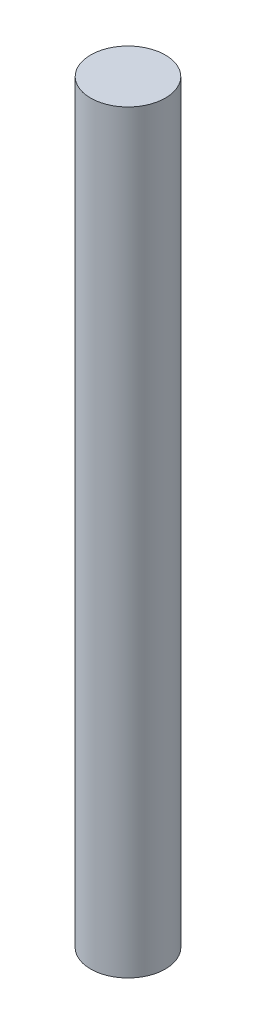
SolidWorks part; units mm, degrees
ref_plane "Front Plane" through (0, 0, 0) normal (0, 0, 1) x (1, 0, 0)
ref_plane "Top Plane" through (0, 0, 0) normal (0, 1, 0) x (1, 0, 0)
ref_plane "Right Plane" through (0, 0, 0) normal (1, 0, 0) x (0, 0, -1)
sketch "Sketch1" plane through (0, 0, 0) normal (0, 1, 0) x (1, 0, 0)
  circle A0 centre (0, 0) radius 5
  dimension "D1" = 10
extrude "Boss-Extrude1" add sketch "Sketch1" along normal blind 100.96
